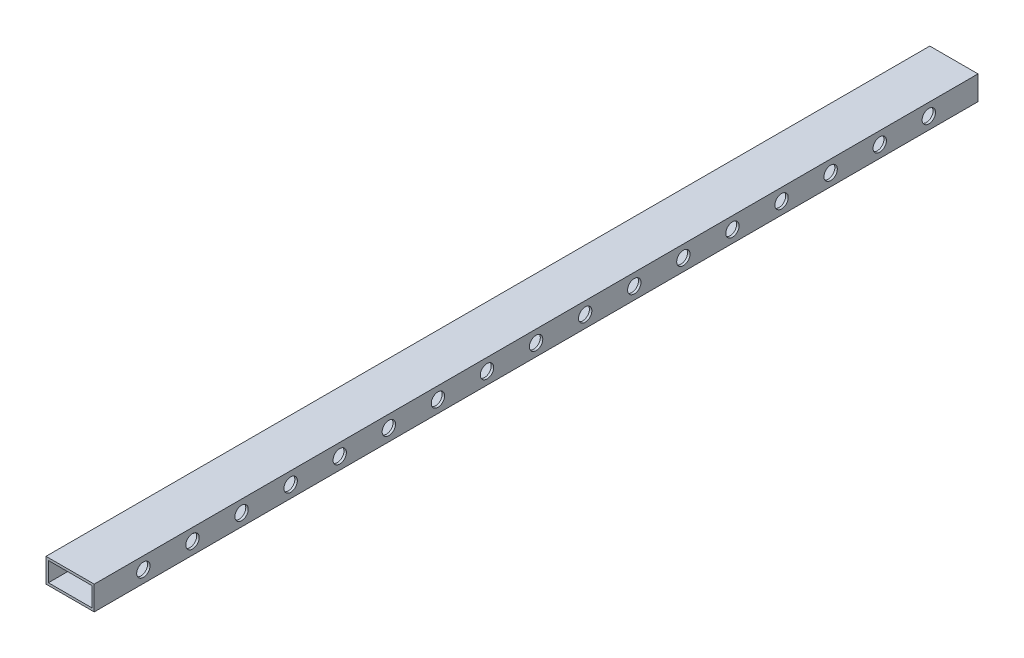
SolidWorks part; units mm, degrees
ref_plane "Plan de face" through (0, 0, 0) normal (0, 0, 1) x (1, 0, 0)
ref_plane "Plan de dessus" through (0, 0, 0) normal (0, 1, 0) x (1, 0, 0)
ref_plane "Plan de droite" through (0, 0, 0) normal (1, 0, 0) x (0, 0, -1)
sketch "Esquisse1" plane through (0, 0, 0) normal (0, 0, 1) x (1, 0, 0)
  line L0 (-32.7851, 0) -> (47.4143, 0) construction
  line L1 (-30, 15) -> (30, 15)
  line L2 (-30, 15) -> (-30, -15)
  line L3 (-30, -15) -> (30, -15)
  line L4 (30, 15) -> (30, -15)
  line L5 (0, 21.8132) -> (0, -24.1643) construction
  dimension "D1" = 60
  dimension "D2" = 30
extrude "Extru.-Mince1" add sketch "Esquisse1" along normal blind 1100 thin
hole_wizard "Trou taraudé 1/2 Rc1" positions "Esquisse5" profile "Esquisse4" size "1/2" standard "GB"
sketch "Esquisse5" plane through (30, 0, 0) normal (1, 0, 0) x (0, 0, -1)
  line L0 (-1211.8429, 0) -> (23.8014, 0) construction
  line L3 (-1100, 15) -> (0, 15) construction
  line L4 (-1100, -15) -> (0, -15) construction
  line L5 (-550, 117.5313) -> (-550, -65.7638) construction
  line L7 (0, -15) -> (0, 15) construction
  line L8 (-1100, -15) -> (-1100, 15) construction
  line L9 (-488.9, 86.3702) -> (-488.9, -53.7061) construction
  line L11 (-427.8, 86.3702) -> (-427.8, -53.7061) construction
  line L13 (-366.7, 86.3702) -> (-366.7, -53.7061) construction
  line L15 (-305.6, 86.3702) -> (-305.6, -53.7061) construction
  line L17 (-244.5, 86.3702) -> (-244.5, -53.7061) construction
  line L19 (-183.4, 86.3702) -> (-183.4, -53.7061) construction
  line L21 (-122.3, 86.3702) -> (-122.3, -53.7061) construction
  line L23 (-61.2, 86.3702) -> (-61.2, -53.7061) construction
  point P0 (-550, 0)
  point P61 (-488.9, 0)
  point P63 (-427.8, 0)
  point P65 (-366.7, 0)
  point P67 (-305.6, 0)
  point P69 (-244.5, 0)
  point P71 (-183.4, 0)
  point P73 (-122.3, 0)
  point P75 (-61.2, 0)
  point P78 (-977.7, 0)
  point P79 (-1038.8, 0)
  point P80 (-916.6, 0)
  point P81 (-855.5, 0)
  point P82 (-794.4, 0)
  point P83 (-733.3, 0)
  point P84 (-672.2, 0)
  point P85 (-611.1, 0)
  dimension "D1" = 61.1
  dimension "D2" = 122.2
  dimension "D3" = 183.3
  dimension "D4" = 244.4
  dimension "D5" = 305.5
  dimension "D6" = 366.6
  dimension "D7" = 427.7
  dimension "D8" = 488.8
sketch "Esquisse4" plane through (30, 0, 550) normal (0, 1, 0) x (0, 0, -1)
  line L0 (0, 0) -> (0, 29.3275)
  line L1 (8.75, 24.07) -> (0, 29.3275)
  line L2 (-8.75, 24.07) -> (0, 29.3275) construction
  line L3 (8.75, 24.07) -> (8.75, 15)
  line L4 (8.75, 15) -> (7.8473, 15)
  line L5 (7.8473, 15) -> (8.3155, 0)
  line L6 (-7.8473, 15) -> (-8.3155, 0) construction
  line L7 (8.3155, 0) -> (0, 0)
  line L8 (0, -6.35) -> (0, 107.95) construction
  line L11 (-8.75, 15) -> (-7.8473, 15) construction
  dimension "Diamètre du trou pour taraudage" = 17.5
  dimension "Profondeur du trou pour taraudage" = 24.07
  dimension "Diamètre du filetage" = 16.631
  dimension "Angle de filetage" = 3.576
  dimension "Profondeur du filetage" = 15
  dimension "Angle de pointe" = 118
hole_wizard "Trou taraudé 3/4 Rc2" positions "Esquisse10" profile "Esquisse9" size "3/4" standard "GB"
sketch "Esquisse10" plane through (0, -15, 0) normal (0, -1, 0) x (1, 0, 0)
  line L0 (0, 1143.7062) -> (0, 918.4026) construction
  line L2 (30, 1100) -> (30, 0) construction
  line L3 (-30, 1100) -> (-30, 0) construction
  line L4 (-45.1237, 950) -> (18.6951, 950) construction
  line L6 (-30, 1100) -> (30, 1100) construction
  point P0 (0, 950)
  dimension "D1" = 150
sketch "Esquisse9" plane through (0, -15, 950) normal (1, 0, 0) x (0, 0, -1)
  line L0 (0, 0) -> (0, 12.2799)
  line L1 (11.5, 5.37) -> (0, 12.2799)
  line L2 (-11.5, 5.37) -> (0, 12.2799) construction
  line L3 (11.5, 5.37) -> (11.5, 16.3)
  line L4 (11.5, 16.3) -> (11.5497, 16.3)
  line L5 (11.5497, 16.3) -> (12.0585, 0)
  line L6 (-11.5497, 16.3) -> (-12.0585, 0) construction
  line L7 (12.0585, 0) -> (0, 0)
  line L8 (0, -6.35) -> (0, 107.95) construction
  line L11 (-11.5, 16.3) -> (-11.5497, 16.3) construction
  dimension "Diamètre du trou pour taraudage" = 23
  dimension "Profondeur du trou pour taraudage" = 5.37
  dimension "Diamètre du filetage" = 24.117
  dimension "Angle de filetage" = 3.576
  dimension "Profondeur du filetage" = 16.3
  dimension "Angle de pointe" = 118
